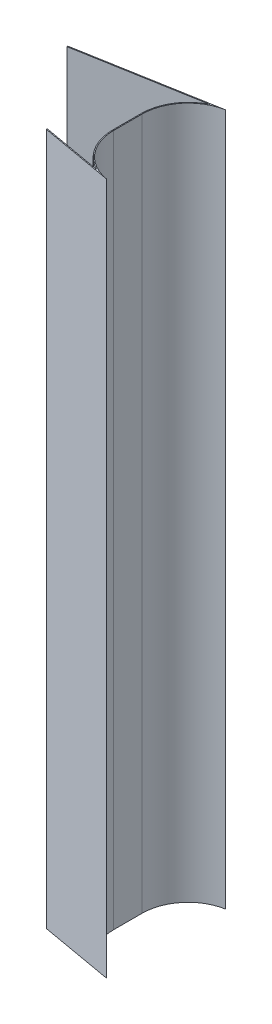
SolidWorks part; units mm, degrees
ref_plane "Front Plane" through (0, 0, 0) normal (0, 0, 1) x (1, 0, 0)
ref_plane "Top Plane" through (0, 0, 0) normal (0, 1, 0) x (1, 0, 0)
ref_plane "Right Plane" through (0, 0, 0) normal (1, 0, 0) x (0, 0, -1)
sketch "Sketch1" plane through (0, 0, 0) normal (0, 1, 0) x (1, 0, 0)
  line L0 (-83.0845, -50.2759) -> (-3.0047, -64.3961)
  line L1 (-44.9834, -14.3679) -> (-44.9834, 16.9469)
  line L2 (-3.0047, 66.9751) -> (-150.8768, 40.9013)
  line L3 (-82.9081, -49.2753) -> (-16.9784, -60.9005)
  line L4 (-45.9994, -14.3679) -> (-45.9994, 16.9469)
  line L5 (-16.9784, 63.4795) -> (-150.7004, 39.9007)
  line L6 (-150.7004, 39.9007) -> (-150.8768, 40.9013)
  line L7 (-83.0845, -50.2759) -> (-82.9081, -49.2753)
  line L8 (-7.424, -61.0377) -> (7.3909, -63.65) construction
  line L9 (-4.7266, 61.5131) -> (12.0653, 64.474) construction
  arc A0 (-3.0047, -64.3961) -> (-44.9834, -14.3679) centre (5.8166, -14.3679) cw
  arc A1 (-44.9834, 16.9469) -> (-3.0047, 66.9751) centre (5.8166, 16.9469) cw
  arc A2 (-16.9784, -60.9005) -> (-45.9994, -14.3679) centre (5.8166, -14.3679) cw
  arc A3 (-45.9994, 16.9469) -> (-16.9784, 63.4795) centre (5.8166, 16.9469) cw
  circle A4 centre (0, 0) radius 39.9034 construction
  circle A8 centre (160.3375, 0) radius 106.4387 construction
  spline S1 degree 2 poles (-2.4384, -59.871) (-2.4384, -60.3558) (-2.2526, -60.8045) (-2.0683, -61.2498) (-1.724, -61.5952) (-1.3803, -61.9399) (-0.9336, -62.1232) (-0.7118, -62.2142) (-0.4766, -62.2619) (-0.2387, -62.3101) (-0.0018, -62.3104) (0.2341, -62.3106) (0.4749, -62.2621) (0.7098, -62.2147) (0.9316, -62.124) (1.3778, -61.9416) (1.7227, -61.5965) (2.067, -61.2519) (2.2523, -60.8052) (2.4384, -60.3567) (2.4384, -59.871) knots 0 0 0 0.125 0.125 0.25 0.25 0.375 0.375 0.4375 0.4375 0.5 0.5 0.5625 0.5625 0.625 0.625 0.75 0.75 0.875 0.875 1 1 1 construction
  spline S2 degree 2 poles (2.4384, 59.871) (2.4384, 60.3558) (2.2526, 60.8045) (2.0683, 61.2498) (1.724, 61.5952) (1.3803, 61.9399) (0.9336, 62.1232) (0.7118, 62.2142) (0.4766, 62.2619) (0.2387, 62.3101) (0.0018, 62.3104) (-0.2341, 62.3106) (-0.4749, 62.2621) (-0.7098, 62.2147) (-0.9316, 62.124) (-1.3778, 61.9416) (-1.7227, 61.5965) (-2.067, 61.2519) (-2.2523, 60.8052) (-2.4384, 60.3567) (-2.4384, 59.871) knots 0 0 0 0.125 0.125 0.25 0.25 0.375 0.375 0.4375 0.4375 0.5 0.5 0.5625 0.5625 0.625 0.625 0.75 0.75 0.875 0.875 1 1 1 construction
  point P6 (-44.9834, -56.9941)
  point P9 (-44.9834, 59.5731)
  dimension "D2" = 50.8
  dimension "D4" = 142.121
  dimension "D9" = 207.4518
  dimension "D1" = 5.08
  dimension "D3" = 1.016
  dimension "D5" = 5.08
  dimension "D6" = 100
  dimension "D7" = 5.08
  dimension "D8" = 100
extrude "Boss-Extrude1" add sketch "Sketch1" along normal blind 762
